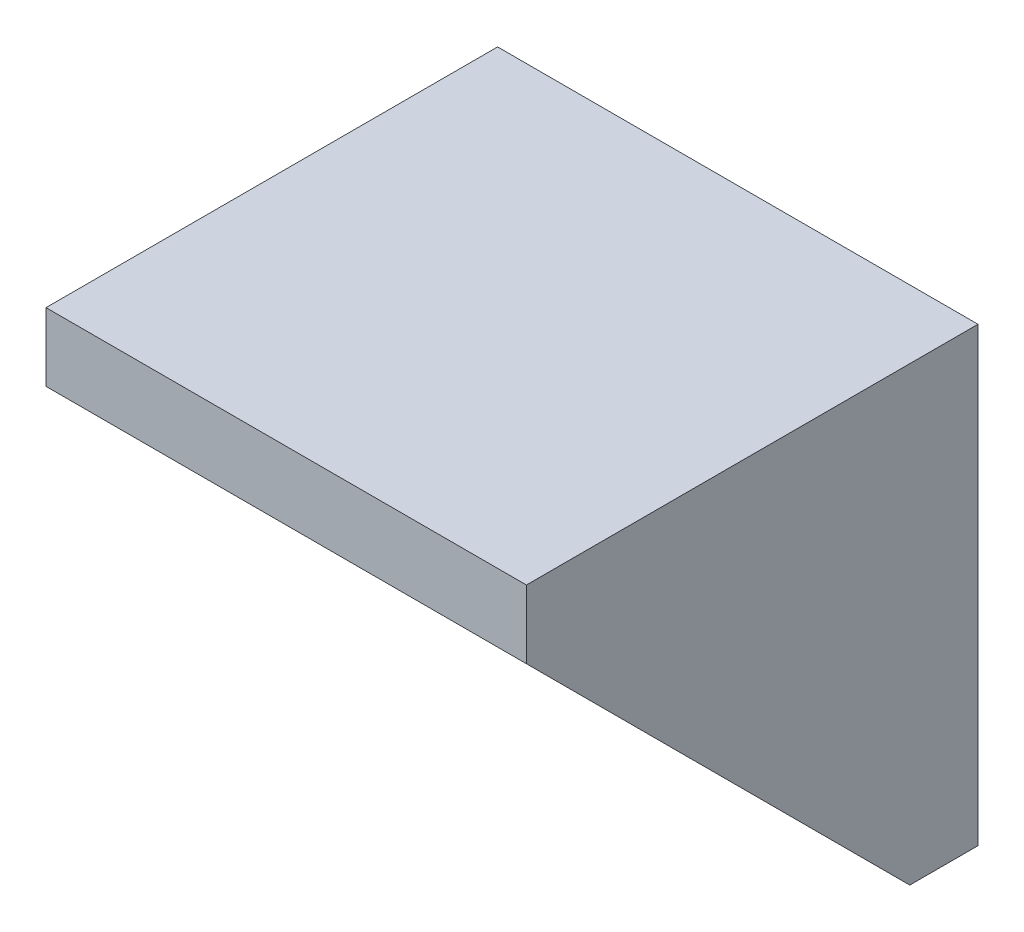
SolidWorks part; units mm, degrees
ref_plane "Front Plane" through (0, 0, 0) normal (0, 0, 1) x (1, 0, 0)
ref_plane "Top Plane" through (0, 0, 0) normal (0, 1, 0) x (1, 0, 0)
ref_plane "Right Plane" through (0, 0, 0) normal (1, 0, 0) x (0, 0, -1)
sketch "Sketch1" plane through (0, 0, 0) normal (1, 0, 0) x (0, 0, -1)
  line L0 (0, 0) -> (0, -35.814)
  line L1 (0, -35.814) -> (-5.4102, -35.814)
  line L2 (-5.4102, -35.814) -> (-35.814, -5.4102)
  line L3 (-35.814, -5.4102) -> (-35.814, 0)
  line L4 (-35.814, 0) -> (0, 0)
  dimension "D1" = 35.814
  dimension "D2" = 5.4102
extrude "Boss-Extrude1" add sketch "Sketch1" along normal blind 38.1
ref_plane "Plane1" through (0, 0, 35.814) normal (0, 0, 1) x (1, 0, 0)
sketch "Sketch2" plane through (0, 0, 35.814) normal (0, 0, 1) x (1, 0, 0)
  line L0 (38.1, -5.4102) -> (0, -5.4102) construction
  line L1 (3.048, -5.4102) -> (35.052, -5.4102)
  line L2 (3.048, -5.4102) -> (3.048, -35.814)
  line L3 (3.048, -35.814) -> (35.052, -35.814)
  line L4 (35.052, -5.4102) -> (35.052, -35.814)
  line L5 (38.1, -35.814) -> (0, -35.814) construction
  line L6 (0, -5.4102) -> (0, -35.814) construction
  line L7 (38.1, -5.4102) -> (38.1, -35.814) construction
  dimension "D1" = 3.048
  dimension "D2" = 3.048
extrude "Cut-Extrude1" cut sketch "Sketch2" against normal blind 30.4038
